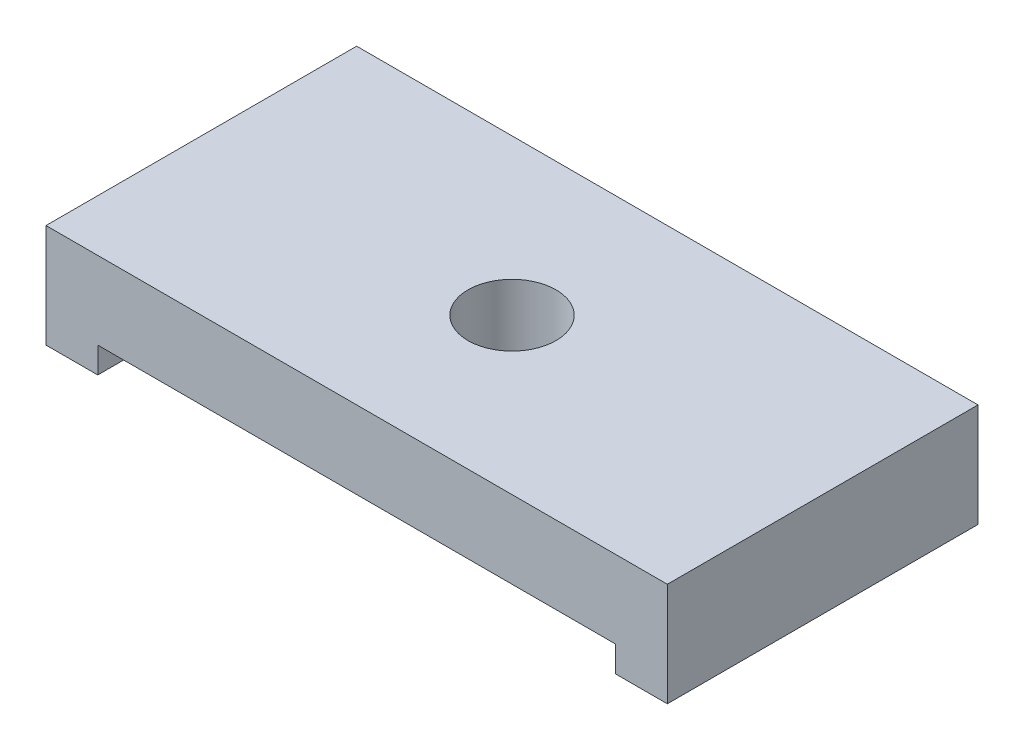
SolidWorks part; units mm, degrees
ref_plane "Plan de face" through (0, 0, 0) normal (0, 0, 1) x (1, 0, 0)
ref_plane "Plan de dessus" through (0, 0, 0) normal (0, 1, 0) x (1, 0, 0)
ref_plane "Plan de droite" through (0, 0, 0) normal (1, 0, 0) x (0, 0, -1)
sketch "Esquisse1" plane through (0, 0, 0) normal (0, 0, 1) x (1, 0, 0)
  line L1 (0, 0) -> (60, 0)
  line L2 (0, 0) -> (0, 10)
  line L3 (0, 10) -> (60, 10)
  line L4 (60, 0) -> (60, 10)
  dimension "D1" = 10
  dimension "D2" = 60
extrude "Extrusion1" add sketch "Esquisse1" along normal blind 30
sketch "Esquisse2" plane through (0, 0, 30) normal (0, 0, 1) x (1, 0, 0)
  line L0 (0, 0) -> (60, 0) construction
  line L1 (5, 0) -> (55, 0)
  line L2 (5, 0) -> (5, 2.5)
  line L3 (5, 2.5) -> (55, 2.5)
  line L4 (55, 0) -> (55, 2.5)
  line L5 (0, 10) -> (0, 0) construction
  dimension "D1" = 5
  dimension "D2" = 50
  dimension "D3" = 2.5
extrude "Enlèv. mat.-Extru.1" cut sketch "Esquisse2" against normal through all
hole_wizard "Trou taraudé M101" positions "Esquisse4" profile "Esquisse3" tap size "M10" standard "ISO"
sketch "Esquisse4" plane through (0, 10, 0) normal (0, 1, 0) x (-1, 0, 0)
  line L0 (0, 30) -> (0, 0) construction
  line L1 (-60, 0) -> (0, 0) construction
  point P0 (-30, 15)
  dimension "D1" = 30
  dimension "D2" = 15
sketch "Esquisse3" plane through (30, 10, 15) normal (1, 0, 0) x (0, 0, 1)
  line L0 (0, 0) -> (0, 10)
  line L1 (0, 10) -> (4.25, 10)
  line L2 (4.25, 10) -> (4.25, 0)
  line L5 (4.25, 0) -> (0, 0)
  line L11 (0, -6.35) -> (0, 107.95) construction
  dimension "Diamètre du trou pour taraudage jusqu'au prochain" = 8.5
  dimension "Profondeur du trou pour taraudage jusqu'au prochain" = 10
